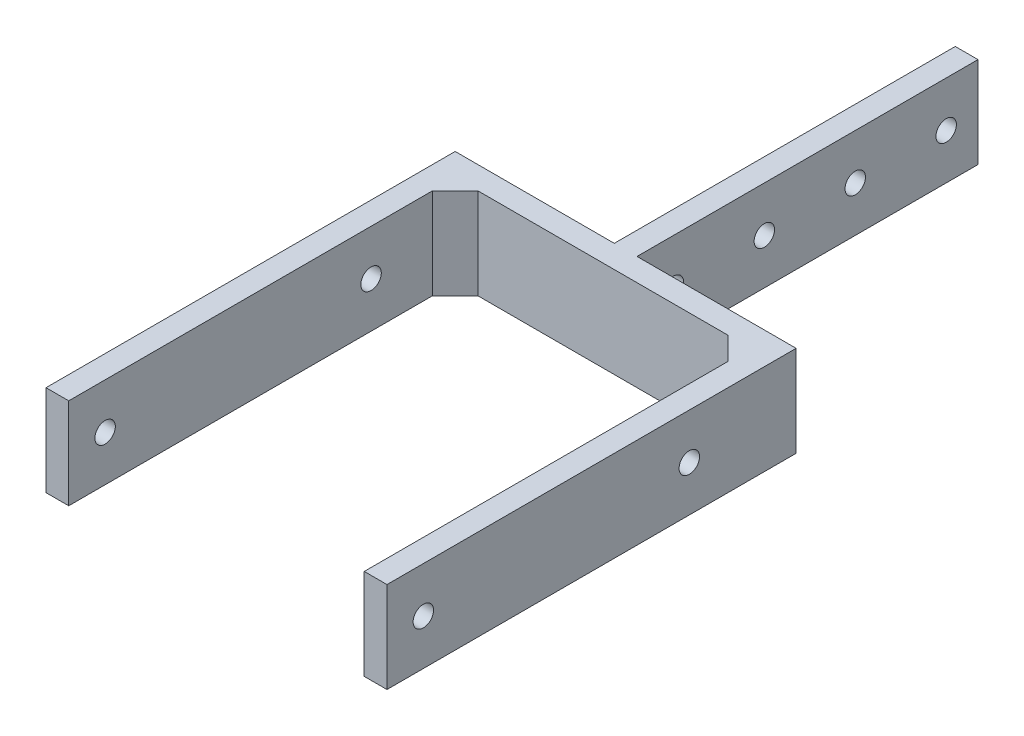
SolidWorks part; units mm, degrees
ref_plane "Front Plane" through (0, 0, 0) normal (0, 0, 1) x (1, 0, 0)
ref_plane "Top Plane" through (0, 0, 0) normal (0, 1, 0) x (1, 0, 0)
ref_plane "Right Plane" through (0, 0, 0) normal (1, 0, 0) x (0, 0, -1)
sketch "Sketch8" plane through (0, 0, 0) normal (0, 1, 0) x (1, 0, 0)
  line L1 (0, 0) -> (75, 0)
  line L2 (0, 0) -> (0, 90)
  line L3 (0, 90) -> (75, 90)
  line L4 (75, 0) -> (75, 90)
  dimension "D1" = 75
  dimension "D2" = 90
extrude "Boss-Extrude6" add sketch "Sketch8" along normal blind 20
sketch "Sketch9" plane through (0, 20, 0) normal (0, 1, 0) x (1, 0, 0)
  line L0 (0, 0) -> (75, 0) construction
  line L1 (5, 0) -> (70, 0)
  line L2 (5, 0) -> (5, 85)
  line L3 (5, 85) -> (70, 85)
  line L4 (70, 0) -> (70, 85)
  line L5 (0, 90) -> (0, 0) construction
  line L6 (75, 0) -> (75, 90) construction
  line L7 (75, 90) -> (0, 90) construction
  dimension "D1" = 5
  dimension "D2" = 5
  dimension "D3" = 5
extrude "Cut-Extrude3" cut sketch "Sketch9" against normal through all
sketch "Sketch10" plane through (0, 0, 0) normal (-1, 0, 0) x (0, 0, 1)
  line L0 (0, 20) -> (0, 0) construction
  circle A0 centre (-8, 10) radius 2.25
  point P6 (0, 10)
  dimension "D1" = 4.5
  dimension "D2" = 8
extrude "Cut-Extrude4" cut sketch "Sketch10" against normal through all
pattern_linear "LPattern2" count 2 spacing 58.5 along (0, 0, -1) of "Cut-Extrude4"
chamfer "Chamfer1" distance 5 angle 45 2 edges at (70, 10, -85) (5, 10, -85)
sketch "Sketch11" plane through (0, 0, -90) normal (0, 0, -1) x (-1, 0, 0)
  line L0 (-75, 0) -> (0, 0) construction
  line L1 (-40, 0) -> (-35, 0)
  line L2 (-40, 0) -> (-40, 20)
  line L3 (-40, 20) -> (-35, 20)
  line L4 (-35, 0) -> (-35, 20)
  line L5 (-75, 20) -> (0, 20) construction
  point P8 (-37.5, 20)
  point P9 (-37.5, 20)
  dimension "D1" = 5
extrude "Boss-Extrude7" add sketch "Sketch11" along normal blind 75
sketch "Sketch12" plane through (35, 0, 0) normal (-1, 0, 0) x (0, 0, 1)
  line L0 (-165, 0) -> (-165, 20) construction
  circle A0 centre (-158, 10) radius 2.25
  point P4 (-165, 10)
  dimension "D1" = 4.5
  dimension "D2" = 7
extrude "Cut-Extrude5" cut sketch "Sketch12" against normal through all
pattern_linear "LPattern3" count 4 spacing 20 along (0, 0, 1) of "Cut-Extrude5"
